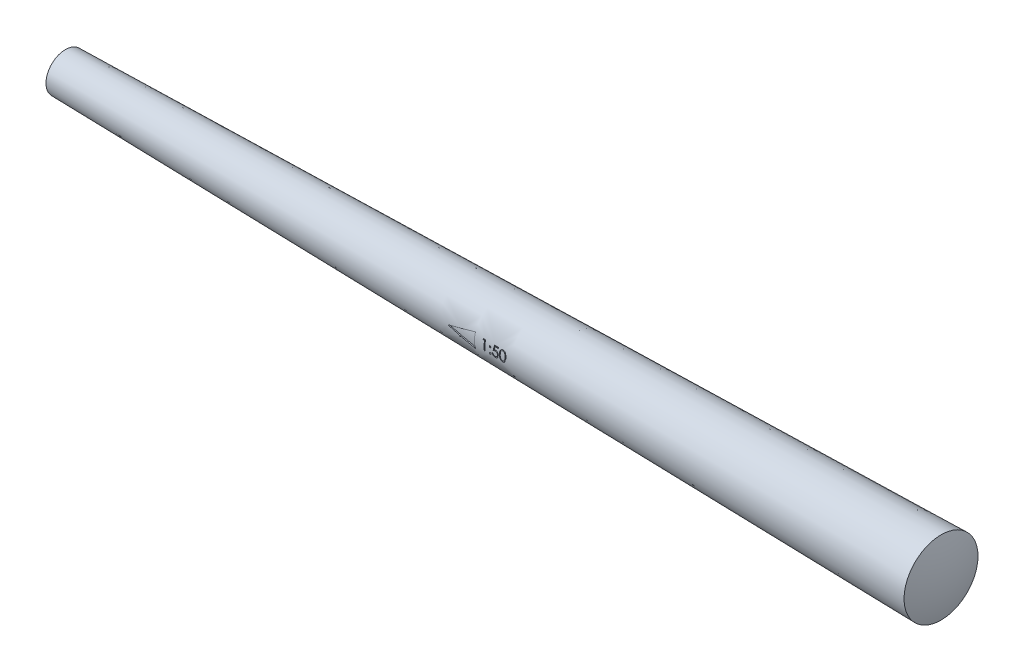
SolidWorks part; units mm, degrees
ref_plane "Front Plane" through (0, 0, 0) normal (0, 0, 1) x (1, 0, 0)
ref_plane "Top Plane" through (0, 0, 0) normal (0, 1, 0) x (1, 0, 0)
ref_plane "Right Plane" through (0, 0, 0) normal (1, 0, 0) x (0, 0, -1)
sketch "Sketch1" plane through (0, 0, 0) normal (1, 0, 0) x (0, 0, -1)
  circle A0 centre (0, 0) radius 2
  dimension "D1" = 4
extrude "Extrude1" add sketch "Sketch1" along normal mid plane 90
draft "Draft1" type of draft neutral plane draft angle 1.146 faces to draft 1 parameters "D1"=1.146
sketch "Sketch2" plane through (0, 0, 0) normal (0, 0, 1) x (1, 0, 0)
  line L0 (-45, 0) -> (-45, 2)
  line L1 (-45, 2) -> (-45, -2) construction
  line L2 (-45, 0) -> (-45.6, 0)
  line L3 (-45.6, 0) -> (-45.6, -2.9) construction
  line L4 (45, 0) -> (45, 3.8001)
  line L5 (45, -3.8001) -> (45, 3.8001) construction
  line L6 (45, 0) -> (45.6, 0)
  line L7 (45.6, 0) -> (45.6, -2.9) construction
  line L8 (-45, -2) -> (45, -3.8001) construction
  arc A0 (-45.6, 0) -> (-45, 2) centre (-41.9667, 0) cw
  arc A1 (45.6, 0) -> (45, 3.8001) centre (33.2663, 0) ccw
  point P14 (0, -2.9)
revolve "Revolve1" add sketch "Sketch2" angle 360 about L2
sketch "Sketch5" plane through (0, 0, 0) normal (0, 0, 1) x (1, 0, 0)
  line L0 (0, 2.9) -> (0, -2.9) construction
  line L1 (45, 3.8001) -> (-45, 2) construction
  line L2 (-45, -2) -> (45, -3.8001) construction
ref_plane "Plane2" through (0, 0, 0) normal (-0.02, 0, 0.9998) x (0.9998, 0, 0.02)
sketch "Sketch6" plane through (0, 0, 0) normal (-0.02, 0, 0.9998) x (0.9998, 0, 0.02)
  line L0 (0, 0) -> (0, 0.75)
  line L1 (0, 2.9) -> (0, -2.9) construction
  line L2 (0, 0.75) -> (-2.799, 0)
  line L3 (-2.799, 0) -> (0, -0.75)
  line L4 (0, -0.75) -> (0, 0)
  line L5 (0, -0.375) -> (4, -0.375) construction
  text T0 "1:50" font "Century Gothic" height 1
  dimension "D1" = 1.5
  dimension "D2" = 30
  dimension "D3" = 4
wrap "Wrap2" sketch "Sketch6" wrap type deboss source sketch "Sketch6" thickness 0.1 parameters "D1"=0.1
equation "\"D2@Sketch2\" = \"D1@Sketch2\""
